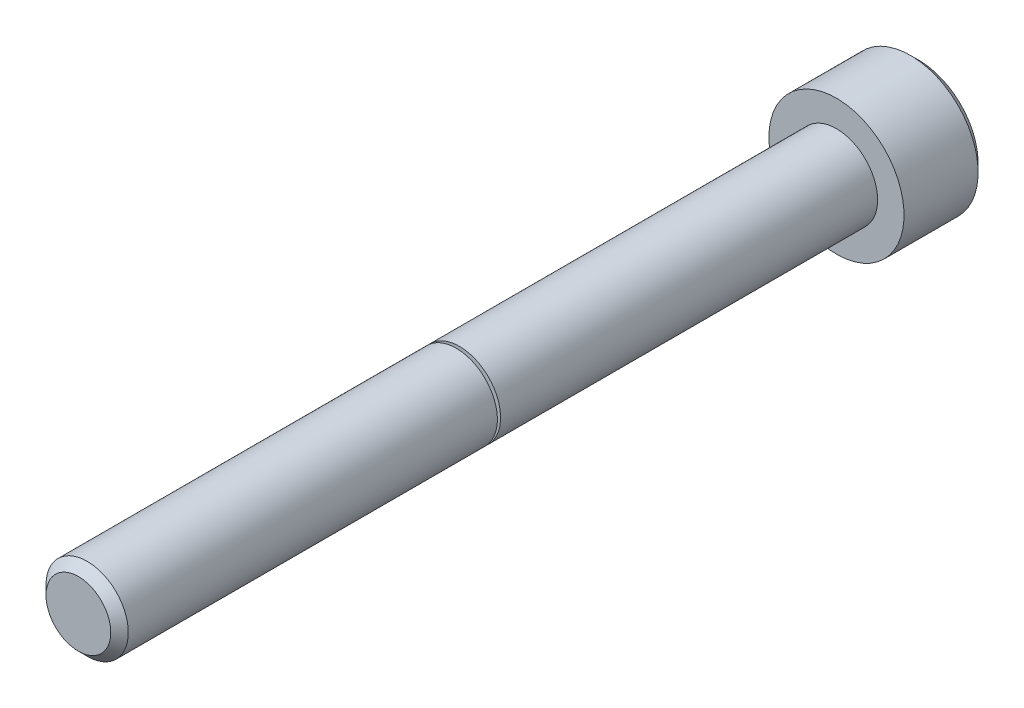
SolidWorks part; units mm, degrees
ref_plane "Front" through (0, 0, 0) normal (0, 0, 1) x (1, 0, 0)
ref_plane "Top" through (0, 0, 0) normal (0, 1, 0) x (1, 0, 0)
ref_plane "Right" through (0, 0, 0) normal (1, 0, 0) x (0, 0, -1)
sketch "Logo3_Revol_Axis" plane through (0, 0, 0) normal (0, 1, 0) x (1, 0, 0)
  line L0 (0, -43.5172) -> (0, 43.5172) construction
sketch "Logo3_bib1" plane through (0, 0, 0) normal (0, -1, 0) x (-1, 0, 0)
  line L0 (0, -44.45) -> (0, 4.826)
  line L1 (0, 4.826) -> (3.4798, 4.826)
  line L2 (3.9624, 4.3434) -> (3.9624, 0)
  line L3 (3.9624, 0) -> (2.413, 0)
  line L4 (2.413, 0) -> (2.413, -22.108)
  line L5 (2.413, -43.9356) -> (1.8987, -44.45)
  line L6 (1.8987, -44.45) -> (0, -44.45)
  line L7 (2.413, -22.108) -> (2.0121, -22.108)
  line L8 (2.0052, -22.1468) -> (2.413, -22.2952)
  line L9 (2.413, -22.2952) -> (2.413, -43.9356)
  line L10 (0, 10.5852) -> (0, -63.2873) construction
  line L11 (3.4798, 4.826) -> (3.9624, 4.3434)
  arc A1 (2.0121, -22.108) -> (2.0052, -22.1468) centre (2.0121, -22.128) ccw
  point P17 (1.8987, -22.108)
  point P19 (3.9624, 4.826)
revolve "Revolve1" add sketch "Logo3_bib1" angle 360 about L10
sketch "Logo3_bib2" plane through (0, 0, -4.826) normal (0, 0, -1) x (1, 0, 0)
  line L1 (2.2914, 0) -> (1.1457, 1.9844)
  line L2 (1.1457, 1.9844) -> (-1.1457, 1.9844)
  line L3 (-1.1457, 1.9844) -> (-2.2914, 0)
  line L4 (-2.2914, 0) -> (-1.1457, -1.9844)
  line L5 (-1.1457, -1.9844) -> (1.1457, -1.9844)
  line L6 (1.1457, -1.9844) -> (2.2914, 0)
  circle A0 centre (0, 0) radius 1.9844 construction
  dimension "Logo3_c1" = 3.9688
extrude "Cut-Extrude1" cut sketch "Logo3_bib2" against normal blind 2.413
equation "\"DIA2@Logo3_bib1\" = \"Logo3_d1-pas@Logo3_bib1\""
equation "\"LGT1@Logo3_bib1\" = \"Logo3_d1@Logo3_bib1\""
equation "\"D1@Cut-Extrude1\" = \"Logo3_d1@Logo3_bib1\"/2."
equation "\"D2@Cosmetic Thread1\" = \"Logo3_d1-pas@Logo3_bib1\""
equation "\"D5@Logo3_bib1\"=\"Logo3_d1@Logo3_bib1\"*.1"
